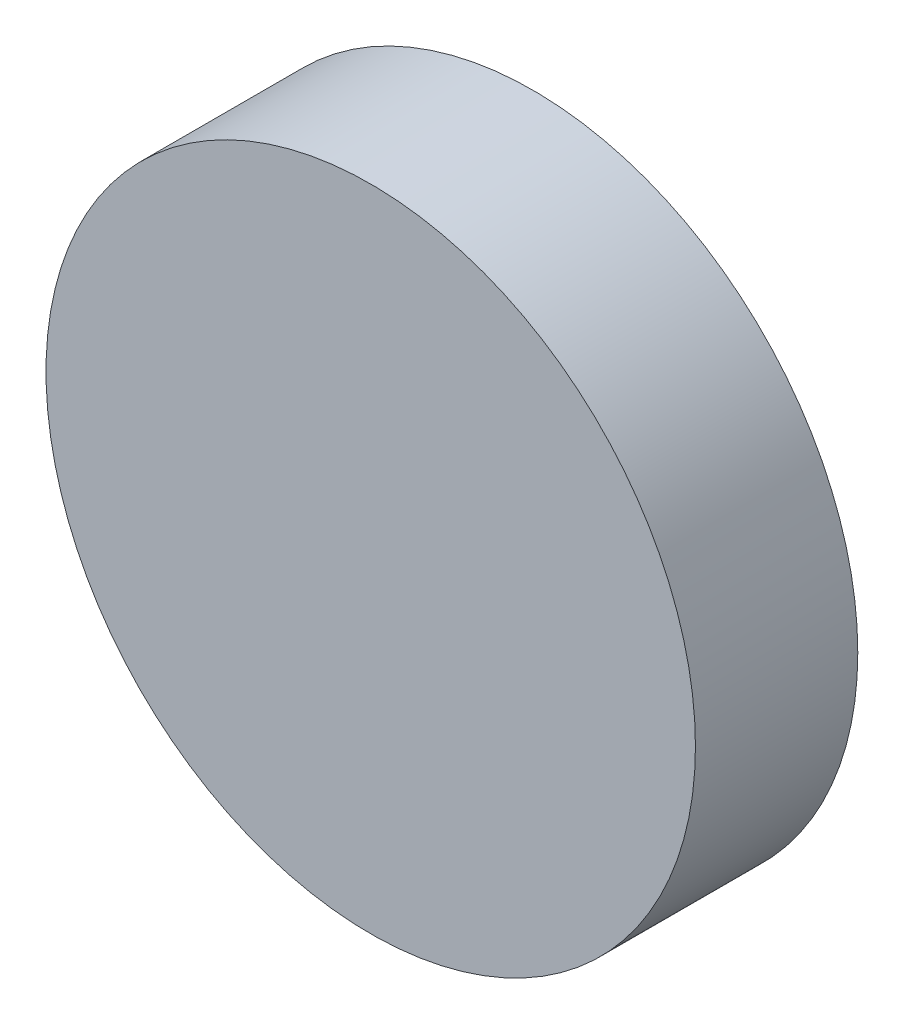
SolidWorks part; units mm, degrees
ref_plane "Plan de face" through (0, 0, 0) normal (0, 0, 1) x (1, 0, 0)
ref_plane "Plan de dessus" through (0, 0, 0) normal (0, 1, 0) x (1, 0, 0)
ref_plane "Plan de droite" through (0, 0, 0) normal (1, 0, 0) x (0, 0, -1)
sketch "Esquisse1" plane through (0, 0, 0) normal (0, 0, 1) x (1, 0, 0)
  circle A0 centre (0, 0) radius 40
  dimension "D1" = 80
extrude "Boss.-Extru.1" add sketch "Esquisse1" along normal blind 20
